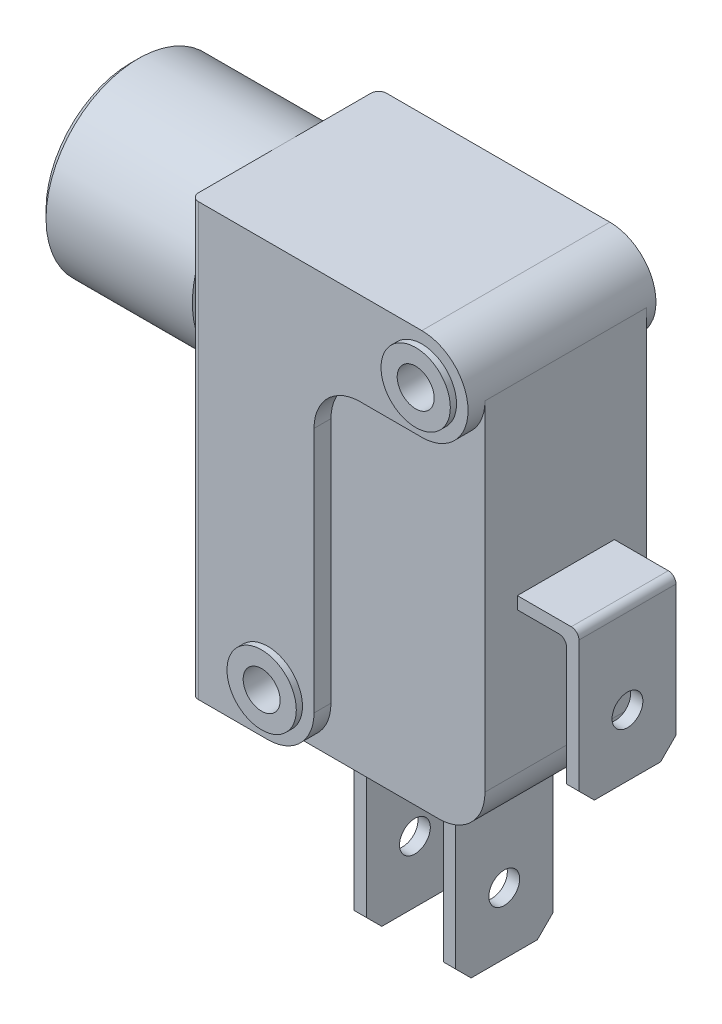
SolidWorks part; units mm, degrees
ref_plane "Ebene vorne" through (0, 0, 0) normal (0, 0, 1) x (1, 0, 0)
ref_plane "Ebene oben" through (0, 0, 0) normal (0, 1, 0) x (1, 0, 0)
ref_plane "Ebene rechts" through (0, 0, 0) normal (1, 0, 0) x (0, 0, -1)
sketch "Skizze1" plane through (0, 0, 0) normal (0, 0, 1) x (1, 0, 0)
  line L1 (0, 0) -> (14, 0)
  line L2 (0, 0) -> (0, 28)
  line L3 (0, 28) -> (18, 28)
  line L4 (18, 4) -> (18, 28)
  arc A0 (14, 0) -> (18, 4) centre (14, 4) ccw
  dimension "D3" = 4
  dimension "D1" = 18
  dimension "D2" = 28
extrude "Aufsatz-Linear austragen1" add sketch "Skizze1" along normal blind 13
sketch "Skizze2" plane through (0, 0, 13) normal (0, 0, 1) x (1, 0, 0)
  line L0 (18, 28) -> (0, 28) construction
  line L1 (18, 4) -> (18, 28) construction
  line L2 (0, 28) -> (0, 0) construction
  line L3 (0, 0) -> (14, 0) construction
  line L4 (15, 22) -> (8, 22)
  line L5 (22.1215, 0) -> (8, 0)
  line L7 (8, 28) -> (8, 30.7053)
  line L8 (8, 3) -> (8, 22)
  line L9 (8, 22) -> (15, 22)
  line L10 (8, 30.7053) -> (22.1215, 30.7053)
  line L11 (8, 28) -> (15, 28)
  line L12 (22.1215, 30.7053) -> (22.1215, 0)
  circle A0 centre (15, 25) radius 1.2
  circle A1 centre (5, 3) radius 1.2
  arc A2 (15, 22) -> (15, 28) centre (15, 25) ccw
  arc A3 (5, 0) -> (8, 3) centre (5, 3) ccw
  dimension "D1" = 2.4
  dimension "D2" = 2.4
  dimension "D3" = 3
  dimension "D4" = 3
  dimension "D5" = 5
  dimension "D8" = 8
  dimension "D7" = 3
  dimension "D6" = 3
extrude "Schnitt-Linear austragen1" cut sketch "Skizze2" against normal blind 13 contours A3 A2 L4 L8 M9 M10 M11 | L12 L10 L7 L5 M12 M11 M10 | A2 M11 M12
sketch "Skizze3" plane through (0, 0, 13) normal (0, 0, 1) x (1, 0, 0)
  line L0 (0, 0) -> (5, 0) construction
  line L1 (0, 28) -> (0, 0) construction
  line L2 (15, 28) -> (0, 28) construction
  circle A0 centre (15, 25) radius 1.2
  circle A1 centre (5, 3) radius 1.2
  arc A2 (15, 22) -> (15, 28) centre (15, 25) ccw construction
  dimension "D1" = 3
  dimension "D2" = 2.4
  dimension "D3" = 5
  dimension "D4" = 2.4
  dimension "D5" = 3
  dimension "D6" = 0
extrude "Schnitt-Linear austragen2" cut sketch "Skizze3" against normal blind 13
sketch "Skizze4" plane through (0, 0, 13) normal (0, 0, 1) x (1, 0, 0)
  line L1 (5, 0) -> (18, 0)
  line L2 (5, 0) -> (5, 1.3753)
  line L3 (16.6224, 25) -> (18, 25)
  line L4 (18, 0) -> (18, 25)
  line L6 (16.6224, 25) -> (16.6224, 23.2166)
  line L7 (16.6224, 23.2166) -> (6.8379, 23.2166)
  line L10 (6.8379, 23.2166) -> (6.8379, 1.3753)
  line L11 (6.8379, 1.3753) -> (5, 1.3753)
  arc A0 (15, 22) -> (15, 28) centre (15, 25) ccw construction
extrude "Aufsatz-Linear austragen2" add sketch "Skizze4" against normal blind 10.5 from offset 1.5
fillet "Verrundung1" radius 3 1 edges at (8, 22, 12.25)
sketch "Skizze6" plane through (0, 0, 13) normal (0, 0, 1) x (1, 0, 0)
  line L2 (0, 0) -> (19.7109, 0)
  line L3 (0, 0) -> (0, 28.1665)
  line L4 (0, 28.1665) -> (19.7109, 28.1665)
  line L5 (19.7109, 0) -> (19.7109, 28.1665)
  circle A0 centre (15, 25) radius 2.25
  circle A1 centre (5, 3) radius 2.25
  dimension "D1" = 4.5
  dimension "D2" = 4.5
extrude "Schnitt-Linear austragen4" cut sketch "Skizze6" against normal blind 0.4
sketch "Skizze7" plane through (0, 0, 0) normal (0, 0, -1) x (-1, 0, 0)
  line L1 (0, 0) -> (-21.1572, 0)
  line L2 (0, 0) -> (0, 35.1331)
  line L3 (0, 35.1331) -> (-21.1572, 35.1331)
  line L4 (-21.1572, 0) -> (-21.1572, 35.1331)
  circle A0 centre (-15, 25) radius 2.25
  circle A1 centre (-5, 3) radius 2.25
  dimension "D1" = 4.5
  dimension "D2" = 4.5
extrude "Schnitt-Linear austragen5" cut sketch "Skizze7" against normal blind 0.4
fillet "Verrundung2" radius 3 1 edges at (18, 0, 6.25)
fillet "Verrundung3" radius 0.5 1 edges at (0, 14, 0.4)
fillet "Verrundung4" radius 0.5 1 edges at (0, 14, 12.6)
sketch "Skizze8" plane through (0, 0, 0) normal (-1, 0, 0) x (0, 0, 1)
  line L0 (6.5, 28) -> (6.5, 22) construction
  line L1 (12.1, 28) -> (0.9, 28) construction
  circle A0 centre (6.5, 22) radius 6
  dimension "D1" = 6
extrude "Aufsatz-Linear austragen4" add sketch "Skizze8" along normal blind 10
chamfer "Fase1" distance 0.5 angle 45 1 edges at (-10, 22, 12.5)
sketch "Skizze9" plane through (-10, 0, 0) normal (-1, 0, 0) x (0, 0, 1)
  circle A0 centre (6.5, 22) radius 4
  dimension "D1" = 8
extrude "Schnitt-Linear austragen6" cut sketch "Skizze9" against normal blind 10
sketch "Skizze10" plane through (0, 0, 11.5) normal (0, 0, 1) x (1, 0, 0)
  line L0 (5, 0) -> (15, 0) construction
  line L1 (18, 13) -> (22, 13)
  line L2 (18, 13) -> (18, 12.2)
  line L3 (18, 12.2) -> (22, 12.2)
  line L4 (22, 13) -> (22, 12.2)
  line L5 (22, 13) -> (21.2, 13)
  line L6 (22, 13) -> (22, 3)
  line L7 (22, 3) -> (21.2, 3)
  line L8 (21.2, 13) -> (21.2, 3)
  line L9 (14, 0) -> (13.2, 0)
  line L10 (14, 0) -> (14, -11)
  line L11 (14, -11) -> (13.2, -11)
  line L12 (13.2, 0) -> (13.2, -11)
  line L13 (18, 3) -> (18, 25) construction
  line L14 (8.2, 0) -> (7.4, 0)
  line L15 (8.2, 0) -> (8.2, -11)
  line L16 (8.2, -11) -> (7.4, -11)
  line L17 (7.4, 0) -> (7.4, -11)
  dimension "D1" = 0.8
  dimension "D2" = 0.8
  dimension "D3" = 0.8
  dimension "D4" = 0.8
  dimension "D5" = 4
  dimension "D6" = 11
  dimension "D7" = 4
  dimension "D8" = 5
  dimension "D9" = 13
  dimension "D10" = 10
extrude "Aufsatz-Linear austragen5" add sketch "Skizze10" against normal blind 6.3 from offset 2.1 contours L8 L1 L3 M13 | L1 L8 L3 L4 | L3 L8 L7 L6 | L17 L16 L15 M11 | L10 L11 L12 L9
chamfer "Fase2" distance 1 angle 45 6 edges at (7.8, -11, 3.1) (7.8, -11, 9.4) (13.6, -11, 3.1) (13.6, -11, 9.4) (21.6, 3, 3.1) (21.6, 3, 9.4)
sketch "Skizze11" plane through (22, 0, 0) normal (1, 0, 0) x (0, 0, -1)
  line L0 (-6.25, 13) -> (-6.25, 3) construction
  line L1 (-3.1, 13) -> (-9.4, 13) construction
  line L2 (-4.1, 3) -> (-8.4, 3) construction
  circle A0 centre (-6.25, 7) radius 1
  dimension "D1" = 2
  dimension "D2" = 4
extrude "Schnitt-Linear austragen7" cut sketch "Skizze11" against normal up to next
sketch "Skizze12" plane through (14, 0, 0) normal (1, 0, 0) x (0, 0, -1)
  line L0 (-6.25, 0) -> (-6.25, -11) construction
  line L1 (-3.1, 0) -> (-9.4, 0) construction
  line L2 (-4.1, -11) -> (-8.4, -11) construction
  circle A0 centre (-6.25, -7) radius 1
  dimension "D1" = 2
  dimension "D2" = 4
extrude "Schnitt-Linear austragen8" cut sketch "Skizze12" against normal blind 10
fillet "Verrundung5" radius 0.5 1 edges at (22, 13, 6.25)
fillet "Verrundung6" radius 0.5 1 edges at (21.2, 12.2, 6.25)
